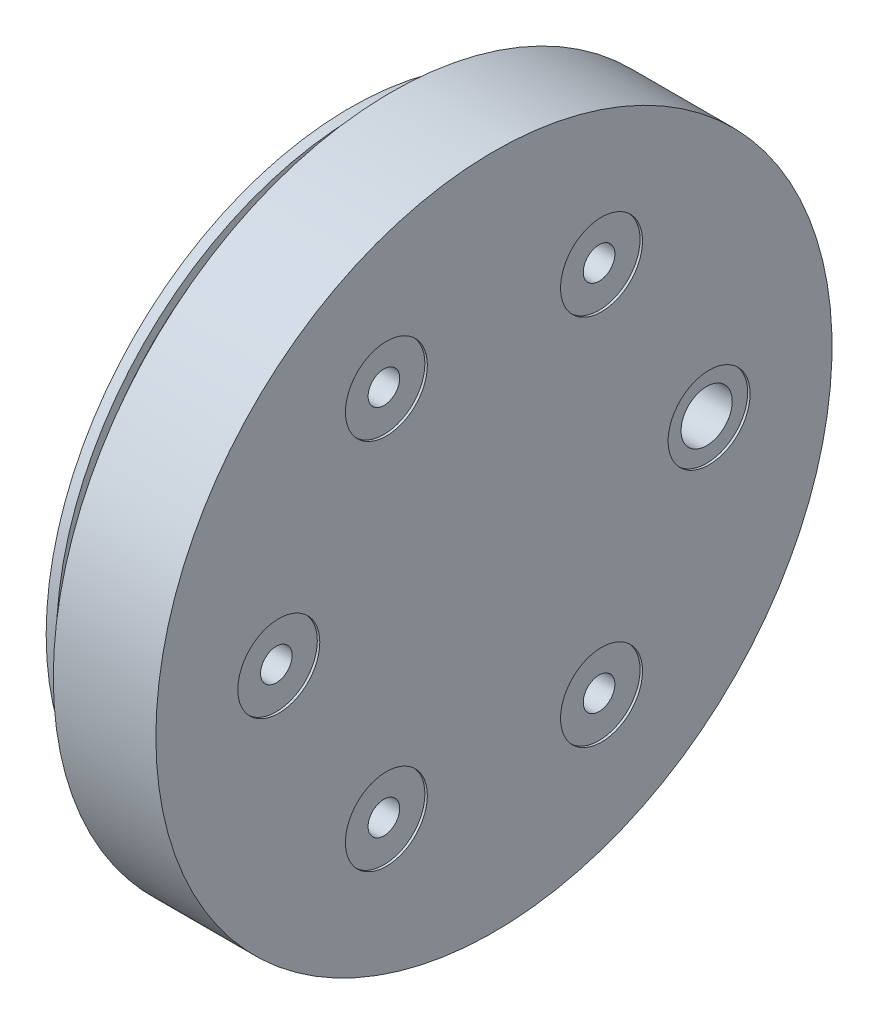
SolidWorks part; units mm, degrees
ref_plane "front" through (0, 0, 0) normal (0, 0, 1) x (1, 0, 0)
ref_plane "top" through (0, 0, 0) normal (0, 1, 0) x (1, 0, 0)
ref_plane "right" through (0, 0, 0) normal (1, 0, 0) x (0, 0, -1)
sketch "Sketch1" plane through (0, 0, 0) normal (0, 0, 1) x (1, 0, 0)
  line L0 (-90.9789, 0) -> (92.7285, 0) construction
  line L1 (0, 0) -> (0, 94.2848)
  line L2 (0, 94.2848) -> (3.175, 94.2848)
  line L3 (3.175, 94.2848) -> (3.175, 91.44)
  line L4 (3.175, 91.44) -> (7.493, 91.44)
  line L5 (7.493, 91.44) -> (7.493, 94.2848)
  line L6 (7.493, 94.2848) -> (12.7, 94.2848)
  line L7 (44.4918, 104.775) -> (12.7, 104.775)
  line L8 (12.7, 100.838) -> (15.5448, 100.838)
  line L9 (15.5448, 100.838) -> (15.5448, 96.52)
  line L10 (15.5448, 96.52) -> (12.7, 96.52)
  line L11 (12.7, 96.52) -> (12.7, 94.2848)
  line L12 (12.7, 104.775) -> (12.7, 100.838)
  line L13 (44.4918, 104.775) -> (44.4918, 0)
  line L14 (44.4918, 0) -> (0, 0)
  dimension "D1" = 104.775
  dimension "D2" = 94.2848
  dimension "D3" = 2.8448
  dimension "D4" = 4.318
  dimension "D5" = 3.175
  dimension "D6" = 4.318
  dimension "D7" = 2.8448
  dimension "D8" = 5.207
  dimension "D9" = 96.52
  dimension "D10" = 31.7918
  dimension "D11" = 2.8448
  dimension "D12" = 2.2352
revolve "Base-Revolve" add sketch "Sketch1" angle 360 about L0
sketch "Sketch3" plane through (44.4918, 0, 0) normal (1, 0, 0) x (0, 0, -1)
  line L0 (0, 0) -> (128.681, 0) construction
  circle A0 centre (66.675, 0) radius 5.7531
  dimension "D1" = 11.5062
  dimension "D2" = 66.675
extrude "Cut-Extrude1" cut sketch "Sketch3" against normal through all
sketch "Sketch4" plane through (44.4918, 0, 0) normal (1, 0, 0) x (0, 0, -1)
  circle A0 centre (66.675, 0) radius 12.7
  dimension "D1" = 25.4
extrude "Cut-Extrude2" cut sketch "Sketch4" against normal blind 0.762
pattern_circular "CirPattern2" count 6 every 60 about axis through (0, 0, 0) along (1, 0, 0) of "Cut-Extrude2"
sketch "Sketch5" plane through (43.7298, 0, 0) normal (1, 0, 0) x (0, 0, -1)
  circle A0 centre (33.3375, 57.7422) radius 4.9022
  dimension "D1" = 9.8044
sketch "Sketch7" plane through (0, 0, 0) normal (-1, 0, 0) x (0, 0, 1)
  circle A0 centre (58.42, -59.69) radius 2.413
  circle A1 centre (-58.42, -59.69) radius 2.413
  circle A2 centre (58.42, 59.69) radius 2.413
  circle A3 centre (-58.42, 59.69) radius 2.413
  point P2 (-6.985, 24.892)
  dimension "D5" = 4.826
  dimension "D8" = 4.826
  dimension "D13" = 4.826
  dimension "D14" = 4.826
  dimension "D1" = 84.582
  dimension "D2" = 24.892
  dimension "D3" = 6.985
  dimension "D4" = 65.405
  dimension "D6" = 51.435
  dimension "D7" = 84.582
  dimension "D9" = 34.798
  dimension "D10" = 51.435
  dimension "D11" = 34.798
  dimension "D12" = 65.405
extrude "Cut-Extrude5" cut sketch "Sketch7" against normal blind 9.525
extrude "Cut-Extrude6" cut sketch "Sketch5" against normal through all
pattern_circular "CirPattern3" count 5 every 60 about axis through (0, 0, 0) along (1, 0, 0) of "Cut-Extrude6"
hole_wizard "5/8-18 Tapped Hole1" positions "Sketch9" profile "Sketch8" tap size "5/8-18" standard "Ansi Inch"
sketch "Sketch9" plane through (43.7298, 0, 0) normal (1, 0, 0) x (0, 0, -1)
  circle A0 centre (66.675, 0) radius 5.7531 construction
  point P0 (66.675, 0)
sketch "Sketch8" plane through (43.7298, 0, -66.675) normal (0, 1, 0) x (0, 0, -1)
  line L0 (0, 0) -> (0, 40.4032)
  line L1 (0, 40.4032) -> (7.3419, 35.9918)
  line L2 (7.3419, 35.9918) -> (7.3419, 31.75)
  line L3 (7.3419, 31.75) -> (7.9375, 31.75)
  line L4 (7.9375, 31.75) -> (7.9375, 0)
  line L5 (7.9375, 0) -> (0, 0)
  line L10 (0, 40.4032) -> (-7.3419, 35.9918) construction
  line L11 (0, -6.35) -> (0, 107.95) construction
  dimension "Tap Drill Dia." = 14.6837
  dimension "Tap Drill Depth" = 35.9918
  dimension "Thread Major Dia." = 15.875
  dimension "Thread Depth" = 31.75
  dimension "Drill Angle" = 118
